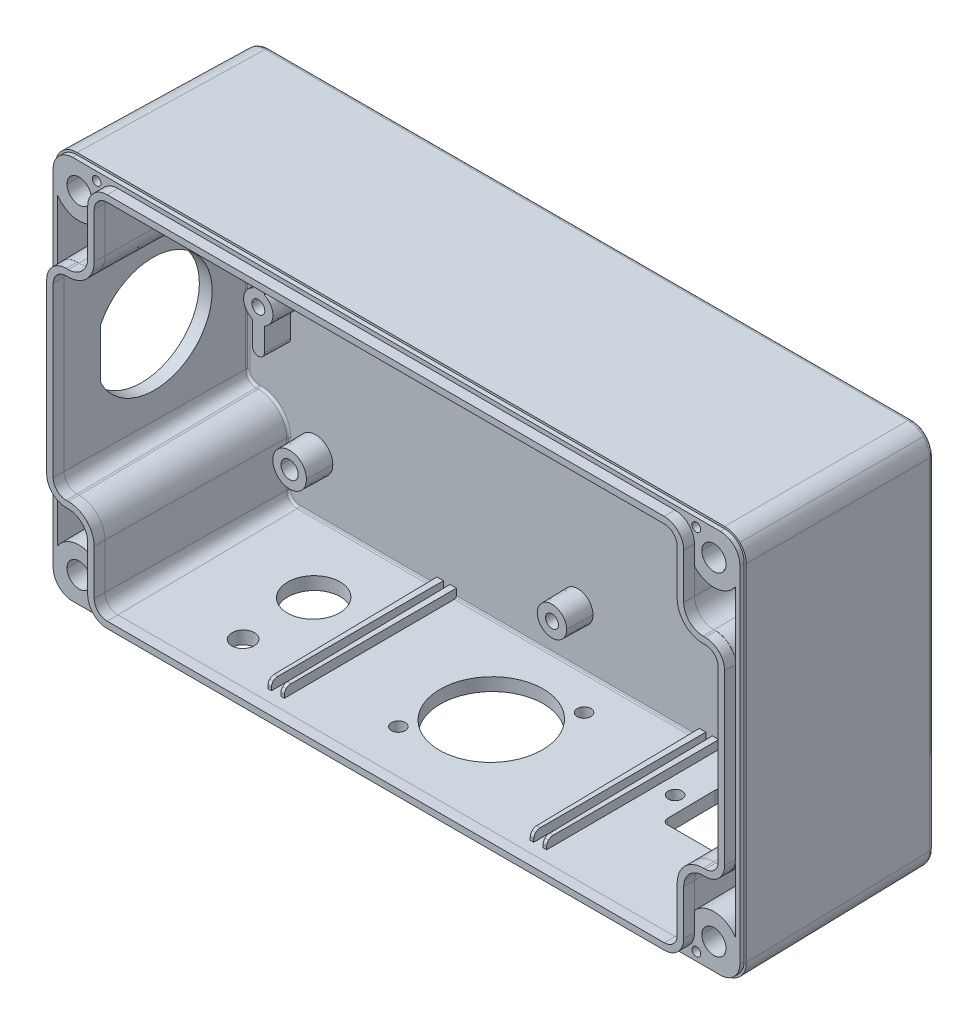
SolidWorks part; units mm, degrees
ref_plane "Ebene vorne" through (0, 0, 0) normal (0, 0, 1) x (1, 0, 0)
ref_plane "Ebene oben" through (0, 0, 0) normal (0, 1, 0) x (1, 0, 0)
ref_plane "Ebene rechts" through (0, 0, 0) normal (1, 0, 0) x (0, 0, -1)
imported_body "Importiert1"
sketch "Skizze1" plane through (0, -77.86, -1.0192) normal (0, -0.9999, -0.0131) x (1, 0, 0)
  line L1 (108.7809, -20.2672) -> (120.7709, -20.2672)
  line L5 (107.5009, -21.5472) -> (107.5009, -32.5372)
  line L6 (108.7809, -33.8172) -> (120.7709, -33.8172)
  line L7 (122.0509, -21.5472) -> (122.0509, -32.5372)
  line L9 (107.5009, -20.2672) -> (122.0509, -33.8172) construction
  line L10 (107.5009, -33.8172) -> (122.0509, -20.2672) construction
  circle A0 centre (67.2759, -20.965) radius 12
  circle A1 centre (57.776, -8.9504) radius 1.6
  circle A2 centre (76.776, -32.9483) radius 1.6
  circle A5 centre (22.2759, -24.8436) radius 6.1
  circle A6 centre (103.7759, -27.0422) radius 1.6
  circle A7 centre (125.7759, -27.0422) radius 1.6
  arc A8 (120.7709, -33.8172) -> (122.0509, -32.5372) centre (120.7709, -32.5372) ccw
  arc A9 (107.5009, -32.5372) -> (108.7809, -33.8172) centre (108.7809, -32.5372) ccw
  arc A10 (108.7809, -20.2672) -> (107.5009, -21.5472) centre (108.7809, -21.5472) ccw
  arc A11 (120.7709, -20.2672) -> (122.0509, -21.5472) centre (120.7709, -21.5472) cw
  circle A13 centre (22.2759, -8.5) radius 2.6
  point P23 (0, 0)
  point P38 (0, 0)
  point P40 (0, 0)
  dimension "D1" = 1.28
extrude "Schnitt-Linear austragen1" cut sketch "Skizze1" against normal blind 10
sketch "Skizze2" plane through (-12.7218, 0, -0.1665) normal (-0.9999, 0, -0.0131) x (-0.0131, 0, 0.9999)
  line L0 (-22.3419, 6.8324) -> (-22.3419, -72.5792)
  line L3 (-43.8503, 6.5509) -> (-0.8335, 7.114) construction
  line L4 (-0.8335, -72.8607) -> (-43.8503, -72.2976) construction
  line L5 (-22.3419, -32.8734) -> (-20.3419, -32.8734)
  line L6 (-20.3419, -32.8734) -> (-8.2419, -32.8734)
  line L7 (-8.2419, -32.8734) -> (-8.2419, -27.1158)
  line L8 (-8.2419, -32.8734) -> (-8.2419, -38.631)
  circle A0 centre (-20.3419, -32.8734) radius 13.4
extrude "Schnitt-Linear austragen2" cut sketch "Skizze2" against normal blind 10 contours L0 A0 | L7 A0 L0 L5 L6 | L0 A0 L8 L6 L5
